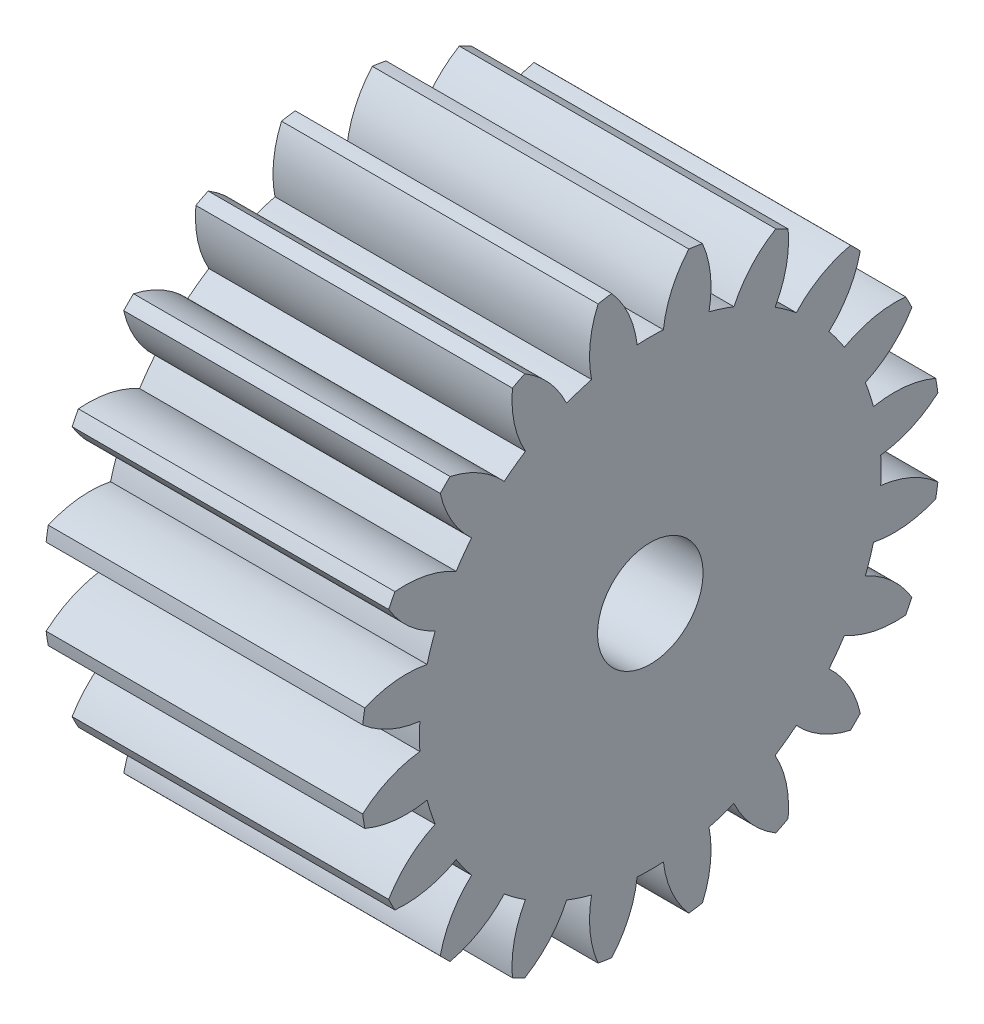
SolidWorks part; units mm, degrees
ref_plane "Plane1" through (0, 0, 0) normal (0, 0, 1) x (1, 0, 0)
ref_plane "Plane2" through (0, 0, 0) normal (0, 1, 0) x (1, 0, 0)
ref_plane "Plane3" through (0, 0, 0) normal (1, 0, 0) x (0, 0, -1)
other "Configuration Table"
sketch "HoldingSke" plane through (0, 0, 0) normal (0, 1, 0) x (1, 0, 0)
  line L0 (0, 0) -> (0.7518, -0.2736)
  line L1 (-15, 0) -> (100, 0) construction
  line L2 (0, 0) -> (-2.1039, 2.3779)
  line L3 (0, 0) -> (-11.863, 4.5341)
  line L4 (0, 0) -> (8.1152, 2.9537)
  line L5 (0, 0) -> (-46.8476, -17.4728)
  line L6 (0, 0) -> (-12.4344, -8.3896)
  line L7 (-2.1039, 2.3779) -> (8.6586, 51.2059)
  line L8 (-76.2, 54.61) -> (-75.3, 54.61)
  line L9 (-71.009, 38.7566) -> (-53.1078, 45.2721)
  line L10 (-76.2, 71.12) -> (104.1128, 71.12)
  line L11 (0, 0) -> (-15, 0)
  line L12 (-76.2, 101.6) -> (-76.155, 101.6)
  line L13 (24.9733, 27.94) -> (52.9518, 28.4284)
  line L14 (24.9733, 27.94) -> (24.9743, 27.94)
  line L15 (24.9733, 27.94) -> (100.4006, 29.5858)
  line L16 (-63.627, -1.25) -> (-12.827, -1.25)
  circle A0 centre (0, 0) radius 2.5
  circle A1 centre (0, 0) radius 10.9365
  circle A2 centre (0, 0) radius 37.5
  circle A3 centre (0, 0) radius 2.5
sketch "BasProSke" plane through (0, 0, 0) normal (0, 1, 0) x (1, 0, 0)
  line L0 (-10, 0) -> (60, 0) construction
  line L1 (0, 0) -> (0, 13.75)
  line L2 (0, 0) -> (15, 0)
  line L3 (15, 0) -> (15, 13.75)
  line L4 (15, 13.75) -> (0, 13.75)
revolve "Base-Revolve" add sketch "BasProSke" angle 360 about L0
sketch "TooCutSke" plane through (0, 0, 0) normal (1, 0, 0) x (0, 0, -1)
  line L1 (0, 0) -> (0, 107) construction
  line L2 (0, 0) -> (-1.0594, 12.455) construction
  line L3 (0, 0) -> (-3.9007, 24.6278) construction
  line L4 (-1.0594, 12.455) -> (-1.9503, 12.3139) construction
  arc A0 (0.6211, 10.9188) -> (-0.6211, 10.9188) centre (0, 0) ccw
  arc A1 (1.8466, 13.6511) -> (-1.8466, 13.6511) centre (0, 0) ccw
  circle A2 centre (0, 0) radius 12.5 construction
  circle A3 centre (0, 0) radius 11.7462 construction
  arc A4 (-0.6211, 10.9188) -> (-1.8466, 13.6511) centre (-5.5866, 10.3326) ccw
  arc A5 (1.8466, 13.6511) -> (0.6211, 10.9188) centre (5.5866, 10.3326) ccw
extrude "ToothCut" cut sketch "TooCutSke" along normal through all
fillet "Breaks" [suppressed] radius 0.025
fillet "RootFillets" [suppressed] radius 0.3135
pattern_circular "TeethCuts" count 20 every 18 about axis through (-10, 0, 0) along (1, 0, 0) of "ToothCut", "RootFillets", "Breaks"
sketch "HubNeaOneSke" plane through (0, 0, 0) normal (-1, 0, 0) x (0, 0, 1)
  circle A0 centre (0, 0) radius 10.9365
extrude "HubNearOne" [suppressed] add sketch "HubNeaOneSke" along normal blind 35.0001
sketch "HubNeaBotSke" plane through (0, 0, 0) normal (-1, 0, 0) x (0, 0, 1)
  circle A0 centre (0, 0) radius 10.9365
extrude "HubNearBoth" [suppressed] add sketch "HubNeaBotSke" along normal blind 17.5
ref_plane "FarPln" through (15, 0, 0) normal (1, 0, 0) x (0, 0, -1)
sketch "HubFarSke" plane through (15, 0, 0) normal (1, 0, 0) x (0, 0, -1)
  circle A0 centre (0, 0) radius 10.9365
extrude "HubFar" [suppressed] add sketch "HubFarSke" along normal blind 17.5
sketch "BorSke" plane through (0, 0, 0) normal (1, 0, 0) x (0, 0, -1)
  circle A0 centre (0, 0) radius 2.5
extrude "Bore" cut sketch "BorSke" along normal mid plane 100.0001
sketch "KeySke" plane through (0, 0, 0) normal (1, 0, 0) x (0, 0, -1)
  line L0 (-1, 0) -> (-1, 3.4)
  line L1 (-1, 3.4) -> (1, 3.4)
  line L2 (1, 3.4) -> (1, 0)
  line L3 (0, 0) -> (0, 34) construction
  line L4 (-1, 0) -> (1, 0)
extrude "Keyway" [suppressed] cut sketch "KeySke" along normal mid plane 100.0001
pattern_circular "Keyway2" [suppressed] count 2 every 90 about axis through (-10, 0, 0) along (1, 0, 0)
equation "' \"Module@HoldingSke\" = 6.35"
equation "' \"Num_teeth@HoldingSke\" = 12"
equation "' \"Ap@HoldingSke\" =  20"
equation "' \"Ap@HoldingSke\" = 20"
equation "' \"Width@HoldingSke\" = 0.5 * 25.4"
equation "' \"Hub_dia@HoldingSke\"= 1 * 25.4"
equation "' \"Hub_dia@HoldingSke\" = 1 * 25.4"
equation "' \"Overall_len@HoldingSke\" = 1.0 * 25.4"
equation "' \"Bore@HoldingSke\" = 0.75 * 25.4"
equation "' \"T_dim@HoldingSke\" = 0.1 * 25.4"
equation "' \"Width@KeySke\" = 0.25 * 25.4"
equation "' \"Show_teeth@HoldingSke\" = 13"
equation "' \"Backlash@HoldingSke\" = 0.009 * 25.4"
equation "' \"Addendum_fac@HoldingSke\" = 1.0"
equation "' \"Dedendum_fac@HoldingSke\" = 1.25"
equation "' \"Dedendum_add@HoldingSke\" = 0.00005 * 25.4"
equation "' \"Clearance_fac@HoldingSke\" = 0.25"
equation "\"Pitch@HoldingSke\" = 1 / \"Module@HoldingSke\""
equation "\"Overcut_dia@TooCutSke\" = (\"Num_teeth@HoldingSke\" + 2 * \"Addendum_fac@HoldingSke\") / \"Pitch@HoldingSke\" + 0.002 * 25.4"
equation "\"Pitch_dia@TooCutSke\" = \"Num_teeth@HoldingSke\" / \"Pitch@HoldingSke\""
equation "\"Base_dia@TooCutSke\" = \"Num_teeth@HoldingSke\" / \"Pitch@HoldingSke\" * cos((\"Ap@HoldingSke\"  * 3.14159265 / 180))"
equation "\"Root_dia@TooCutSke\" = (\"Num_teeth@HoldingSke\" + 2) / \"Pitch@HoldingSke\" - 2 * (\"Addendum_fac@HoldingSke\" + \"Dedendum_fac@HoldingSke\") / \"Pitch@HoldingSke\" - \"Dedendum_add@HoldingSke\" * 2"
equation "\"Half_ang@TooCutSke\" = 180 / \"Num_teeth@HoldingSke\""
equation "\"Half_CT@TooCutSke\" = \"Num_teeth@HoldingSke\" / \"Pitch@HoldingSke\" * sin((3.14159265 / 2 / \"Num_teeth@HoldingSke\")) / 2 - 7 * \"Backlash@HoldingSke\" / 4"
equation "\"Flank_rad@TooCutSke\" = \"Num_teeth@HoldingSke\" / \"Pitch@HoldingSke\" / 5"
equation "\"Radius@RootFillets\" = \"Clearance_fac@HoldingSke\" / \"Pitch@HoldingSke\" + \"Dedendum_add@HoldingSke\""
equation "\"Break_rad@Breaks\" = 0.02 / \"Pitch@HoldingSke\""
equation "\"Thickness@HoldingSke\" = \"Width@HoldingSke\""
equation "\"OAL@HoldingSke\" = \"Thickness@HoldingSke\""
equation "\"MHD@HoldingSke\" = (\"Num_teeth@HoldingSke\" + 2) / \"Pitch@HoldingSke\" - 2 * (\"Addendum_fac@HoldingSke\" + \"Dedendum_fac@HoldingSke\")  / \"Pitch@HoldingSke\" - \"Dedendum_add@HoldingSke\" * 2"
equation "\"MBD@HoldingSke\" = (\"Num_teeth@HoldingSke\" + 2) / \"Pitch@HoldingSke\" - 2 * (\"Addendum_fac@HoldingSke\" + \"Dedendum_fac@HoldingSke\")  / \"Pitch@HoldingSke\" - \"Dedendum_add@HoldingSke\" * 2 - 0.002 * 25.4"
equation "\"MHD@HoldingSke\" = ((sgn( \"MHD@HoldingSke\" - \"Hub_dia@HoldingSke\" )-1)*( \"MHD@HoldingSke\" - \"Hub_dia@HoldingSke\" ))/-2+ \"Hub_dia@HoldingSke\""
equation "\"MBD@HoldingSke\" = ((sgn( \"MBD@HoldingSke\" - \"Bore@HoldingSke\" )-1)*( \"MBD@HoldingSke\" - \"Bore@HoldingSke\" ))/-2+ \"Bore@HoldingSke\""
equation "\"OAL@HoldingSke\" = ((sgn( \"OAL@HoldingSke\" - \"Overall_len@HoldingSke\" )+1)*( \"OAL@HoldingSke\" - \"Overall_len@HoldingSke\" ))/2 + \"Overall_len@HoldingSke\" + 0.000002 * 25.4"
equation "\"Num_teeth@TeethCuts\" = int( \"Show_teeth@HoldingSke\" ) + 1"
equation "\"Num_teeth@TeethCuts\" = ((sgn( \"Num_teeth@TeethCuts\" - \"Num_teeth@HoldingSke\" )-1)*( \"Num_teeth@TeethCuts\" - \"Num_teeth@HoldingSke\" ))/-2+ \"Num_teeth@HoldingSke\""
equation "\"Num_teeth@TeethCuts\" = ((sgn( \"Num_teeth@TeethCuts\" - 2.0)+1)*( \"Num_teeth@TeethCuts\" - 2.0))/2 +2.0"
equation "\"Angle@TeethCuts\" = 360.0 / \"Num_teeth@HoldingSke\""
equation "\"Diameter@BasProSke\" = (\"Num_teeth@HoldingSke\" + 2 * \"Addendum_fac@HoldingSke\") / \"Pitch@HoldingSke\""
equation "\"Thickness@BasProSke\"  = \"Thickness@HoldingSke\""
equation "' \"Fillet_rad@BasProSke\" =  \"Thickness@HoldingSke\" * 0.05"
equation "' \"Fillet_rad@BasProSke\" = \"Thickness@HoldingSke\" * 0.05"
equation "\"MHD@HoldingSke\" = ((sgn( \"MHD@HoldingSke\" - \"Root_dia@TooCutSke\" )-1)*( \"MHD@HoldingSke\" - \"Root_dia@TooCutSke\" ))/-2+ \"Root_dia@TooCutSke\""
equation "\"Diameter@HubNeaOneSke\" = \"MHD@HoldingSke\""
equation "\"Length@HubNearOne\" = \"OAL@HoldingSke\" - \"Thickness@BasProSke\""
equation "\"Diameter@HubNeaBotSke\" = \"MHD@HoldingSke\""
equation "\"Length@HubNearBoth\" = ( \"OAL@HoldingSke\" - \"Thickness@BasProSke\" ) / 2.0"
equation "\"Thickness@FarPln\" = \"Thickness@BasProSke\""
equation "\"Diameter@HubFarSke\" = \"MHD@HoldingSke\""
equation "\"Length@HubFar\" = ( \"OAL@HoldingSke\" - \"Thickness@BasProSke\" ) / 2.0"
equation "\"Diameter@BorSke\" = \"MBD@HoldingSke\""
equation "\"D1@Bore\" = \"OAL@HoldingSke\" * 2.0"
equation "\"D1@Keyway\" = \"OAL@HoldingSke\" * 2.0"
equation "\"Offset@KeySke\" = \"T_dim@HoldingSke\" + \"MBD@HoldingSke\" / 2.0"
